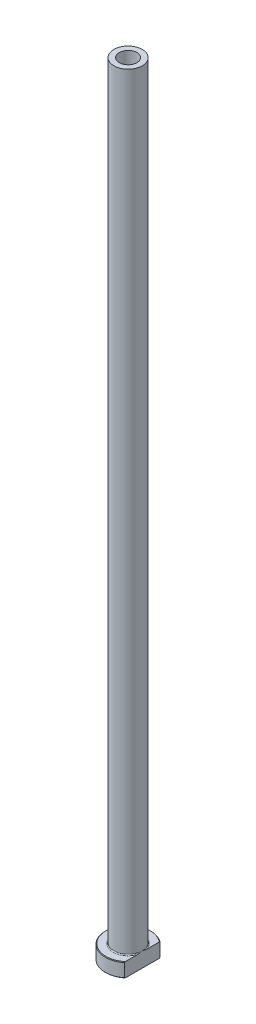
SolidWorks part; units mm, degrees
ref_plane "Front Plane" through (0, 0, 0) normal (0, 0, 1) x (1, 0, 0)
ref_plane "Top Plane" through (0, 0, 0) normal (0, 1, 0) x (1, 0, 0)
ref_plane "Right Plane" through (0, 0, 0) normal (1, 0, 0) x (0, 0, -1)
sketch "Sketch1" plane through (0, 0, 0) normal (0, 0, 1) x (1, 0, 0)
  line L0 (-3.1, 275) -> (-5, 275)
  line L1 (-5, 275) -> (-5, 5)
  line L2 (-5, 5) -> (-8, 5)
  line L3 (-8, 5) -> (-8, 0)
  line L4 (7.15, 0) -> (-7.15, 0) construction
  line L5 (-8, 0) -> (-3.35, 0)
  line L6 (-3.1, 230) -> (-3.1, 275)
  line L7 (0, 92.1877) -> (0, -15.5353) construction
  line L8 (0, -8.8) -> (0, 8.8) construction
  line L9 (-3.1, 230) -> (-3.35, 218)
  line L10 (-3.35, 218) -> (-3.35, 0)
  dimension "D1" = 0.25
  dimension "ID" = 6.2
  dimension "OD" = 10
  dimension "L" = 275
  dimension "H" = 16
  dimension "T" = 5
  dimension "N" = 45
  dimension "D2" = 12
  dimension "L-N" = 230
revolve "Revolve1" add sketch "Sketch1" angle 360 about L7
fillet "Fillet1" radius 0.3 1 edges at (0, 5, 5)
chamfer "Chamfer1" distance 0.2 angle 45 2 edges at (0, 5, 8) (0, 0, 8)
sketch "Sketch2" plane through (0, 0, 0) normal (0, -1, 0) x (1, 0, 0)
  line L0 (5, 6.245) -> (5, -6.245)
  circle A0 centre (0, 0) radius 8 construction
  arc A1 (5, 6.245) -> (5, -6.245) centre (0, 0) cw
  circle A2 centre (0, 0) radius 5 construction
extrude "Cut-Extrude1" cut sketch "Sketch2" against normal through all
chamfer "Chamfer2" distance 0.5 angle 45 1 edges at (0, 0, 3.35)
